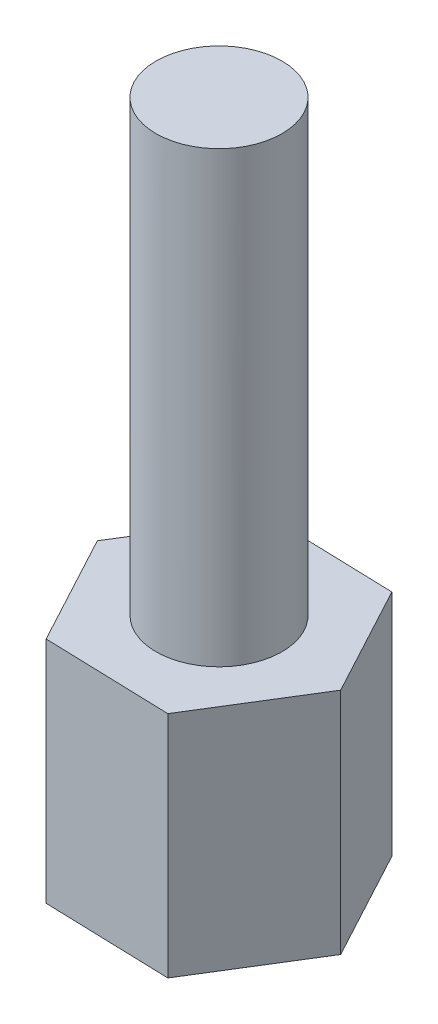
SolidWorks part; units mm, degrees
ref_plane "Front Plane" through (0, 0, 0) normal (0, 0, 1) x (1, 0, 0)
ref_plane "Top Plane" through (0, 0, 0) normal (0, 1, 0) x (1, 0, 0)
ref_plane "Right Plane" through (0, 0, 0) normal (1, 0, 0) x (0, 0, -1)
sketch "Sketch1" plane through (0, 0, 0) normal (0, 1, 0) x (1, 0, 0)
  line L1 (1.298, -2.4158) -> (2.7411, -0.0838)
  line L2 (2.7411, -0.0838) -> (1.4431, 2.332)
  line L3 (1.4431, 2.332) -> (-1.298, 2.4158)
  line L4 (-1.298, 2.4158) -> (-2.7411, 0.0838)
  line L5 (-2.7411, 0.0838) -> (-1.4431, -2.332)
  line L6 (-1.4431, -2.332) -> (1.298, -2.4158)
  circle A0 centre (0, 0) radius 2.375 construction
  dimension "D1" = 4.75
extrude "Extrude1" add sketch "Sketch1" along normal blind 5
sketch "Sketch2" plane through (0, 5, 0) normal (0, 1, 0) x (-1, 0, 0)
  circle A0 centre (0, 0) radius 1.375
  dimension "D1" = 2.75
extrude "Extrude2" add sketch "Sketch2" along normal blind 9.8
sketch "Sketch3" plane through (0, 0, 0) normal (0, -1, 0) x (1, 0, 0)
  circle A0 centre (0, 0) radius 1.36
  dimension "D1" = 2.72
extrude "Cut-Extrude1" cut sketch "Sketch3" against normal blind 4
